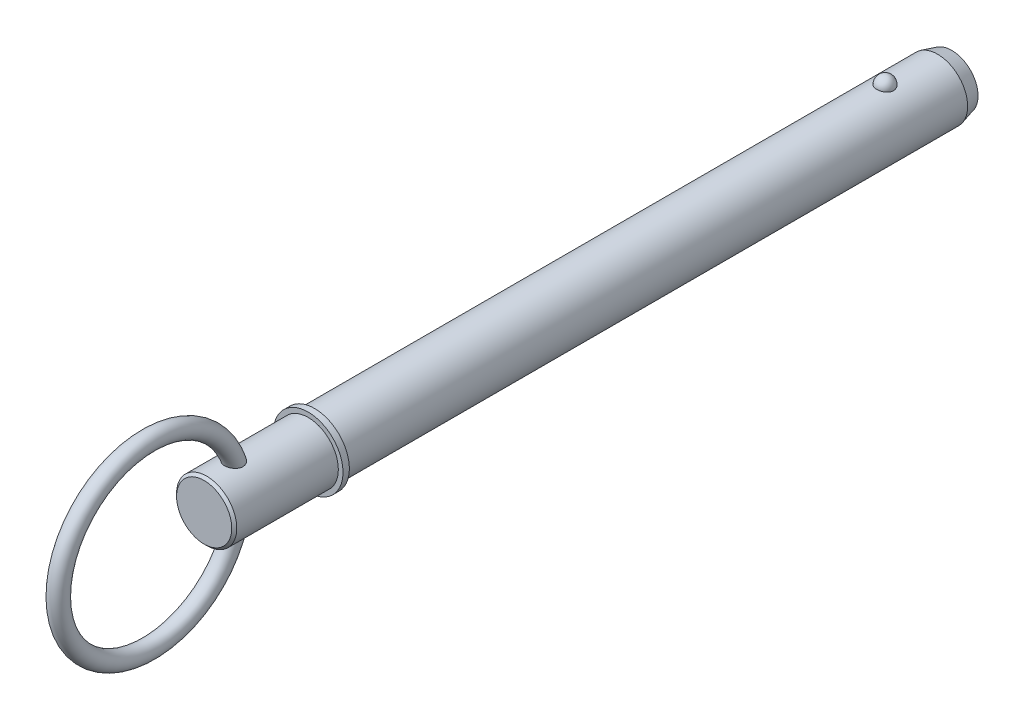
SolidWorks part; units mm, degrees
ref_plane "Front Plane" through (0, 0, 0) normal (0, 0, 1) x (1, 0, 0)
ref_plane "Top Plane" through (0, 0, 0) normal (0, 1, 0) x (1, 0, 0)
ref_plane "Right Plane" through (0, 0, 0) normal (1, 0, 0) x (0, 0, -1)
sketch "Sketch2" plane through (0, 0, 0) normal (0, 0, 1) x (1, 0, 0)
  circle A0 centre (0, 0) radius 9.525
  point P3 (0, 9.525)
  dimension "D1" = 19.05
extrude "Boss-Extrude1" add sketch "Sketch2" along normal blind 177.8
sketch "Sketch3" plane through (0, 0, 0) normal (0, 0, -1) x (-1, 0, 0)
  circle A0 centre (0, 0) radius 9.525
  dimension "D1" = 19.05
extrude "Boss-Extrude2" add sketch "Sketch3" along normal blind 23.8
chamfer "Chamfer1" distance 4.5 angle 15 1 edges at (-9.525, 0, -23.8)
sketch "Sketch18" plane through (0, 0, 0) normal (1, 0, 0) x (0, 0, -1)
  line L0 (19.3, 9.525) -> (-177.8, 9.525) construction
  line L1 (2.69, 12.215) -> (2.69, 6.835)
  line L2 (-177.8, -9.525) -> (19.3, -9.525) construction
  arc A0 (2.69, 12.215) -> (2.69, 6.835) centre (2.69, 9.525) ccw
  point P4 (0, 9.525)
  dimension "D1" = 21.74
revolve "Revolve1" add sketch "Sketch18" angle 360 about L1
sketch "Sketch19" plane through (0, 0, 0) normal (1, 0, 0) x (0, 0, -1)
  line L0 (-33.7288, 0) -> (-46.4542, 0) construction
sketch "Sketch20" plane through (0, 0, 0) normal (1, 0, 0) x (0, 0, -1)
  line L0 (-177.8, 0) -> (-177.8, 11)
  line L1 (-177.8, 9.525) -> (-177.8, -9.525) construction
  line L2 (-177.8, 11) -> (-179.8, 11)
  line L3 (-179.8, 11) -> (-179.8, 0)
  line L4 (-33.7288, 0) -> (-46.4542, 0) construction
  line L5 (-179.8, 0) -> (-177.8, 0)
  dimension "D1" = 11
  dimension "D2" = 2
revolve "Revolve2" add sketch "Sketch20" angle 360 about L0
sketch "Sketch21" plane through (0, 0, 177.8) normal (0, 0, -1) x (-1, 0, 0)
  circle A0 centre (0, 0) radius 9.525
  dimension "D1" = 19.05
extrude "Boss-Extrude3" add sketch "Sketch21" against normal blind 34.93
chamfer "Chamfer2" distance 0.8 angle 45 1 edges at (-9.525, 0, 212.73)
sketch "Sketch23" plane through (0, 0, 0) normal (1, 0, 0) x (0, 0, -1)
  line L0 (-212.73, 8.725) -> (-212.73, -8.725) construction
  circle A0 centre (-230.305, 0) radius 28.575
  point P2 (-201.73, 0)
  dimension "D1" = 57.15
  dimension "D2" = 11
sketch "Sketch24" plane through (0, 0, 0) normal (0, 1, 0) x (1, 0, 0)
  circle A0 centre (0, -201.73) radius 2.75
  dimension "D1" = 5.5
sweep "Sweep1" add profiles "Sketch24" path "Sketch23"
